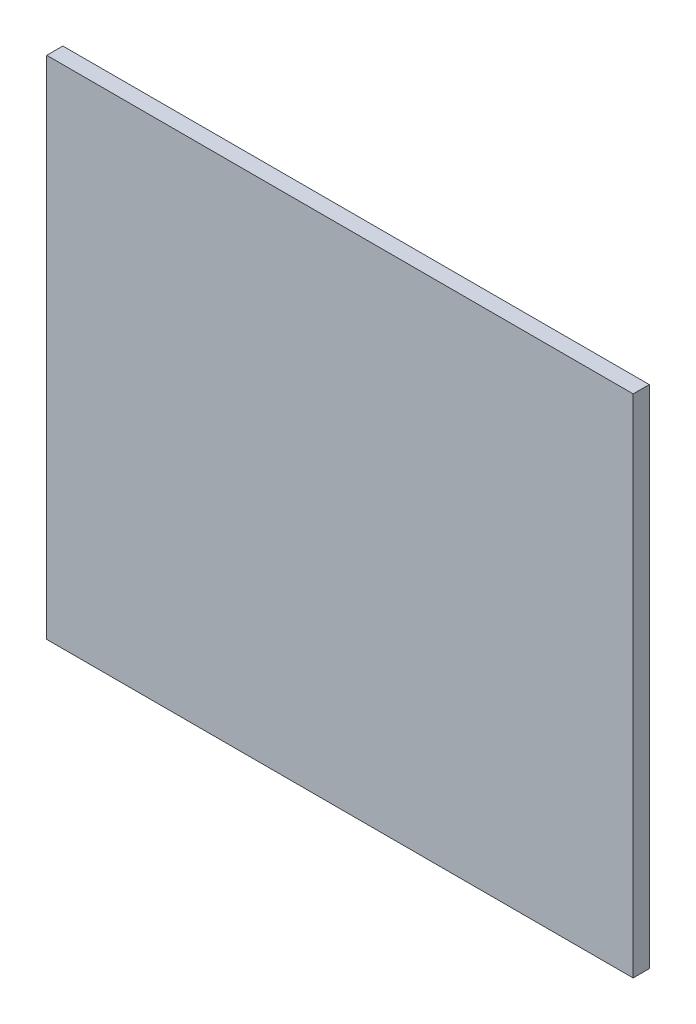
SolidWorks part; units mm, degrees
ref_plane "Plan de face" through (0, 0, 0) normal (0, 0, 1) x (1, 0, 0)
ref_plane "Plan de dessus" through (0, 0, 0) normal (0, 1, 0) x (1, 0, 0)
ref_plane "Plan de droite" through (0, 0, 0) normal (1, 0, 0) x (0, 0, -1)
sketch "Esquisse1" plane through (0, 0, 0) normal (0, 0, 1) x (1, 0, 0)
  line L1 (-655, 565) -> (0, 565)
  line L2 (-655, 565) -> (-655, 0)
  line L3 (-655, 0) -> (0, 0)
  line L4 (0, 565) -> (0, 0)
  dimension "D1" = 655
  dimension "D2" = 565
extrude "Boss.-Extru.1" add sketch "Esquisse1" along normal blind 18
